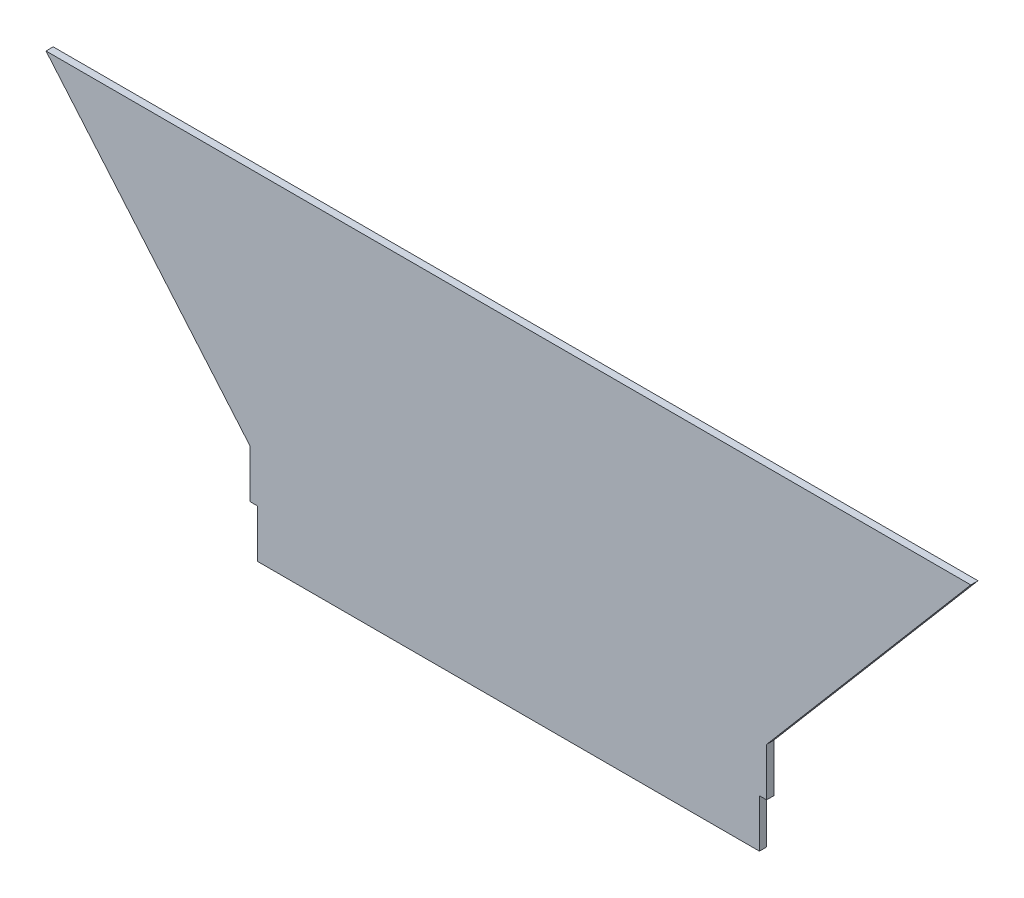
SolidWorks part; units mm, degrees
ref_plane "前视基准面" through (0, 0, 0) normal (0, 0, 1) x (1, 0, 0)
ref_plane "上视基准面" through (0, 0, 0) normal (0, 1, 0) x (1, 0, 0)
ref_plane "右视基准面" through (0, 0, 0) normal (1, 0, 0) x (0, 0, -1)
sketch "草图1" plane through (0, 0, 0) normal (0, 0, 1) x (1, 0, 0)
  line L1 (-107.5, -70) -> (107.5, -70)
  line L2 (-107.5, -70) -> (-107.5, 70)
  line L3 (-107.5, 70) -> (107.5, 70)
  line L4 (107.5, -70) -> (107.5, 70)
  line L5 (-107.5, -70) -> (107.5, 70) construction
  line L6 (-107.5, 70) -> (107.5, -70) construction
  point P0 (0, 0)
  dimension "D1" = 140
  dimension "D2" = 215
extrude "凸台-拉伸1" add sketch "草图1" along normal blind 3
sketch "草图3" plane through (0, 0, 0) normal (0, 0, 1) x (1, 0, 0)
  line L0 (-107.5, -30) -> (-192.5, 70)
  line L1 (-107.5, 70) -> (-107.5, -70) construction
  line L2 (-192.5, 70) -> (192.5, 70)
  line L3 (192.5, 70) -> (107.5, -30)
  line L4 (107.5, -70) -> (107.5, 70) construction
  line L5 (-107.5, -30) -> (107.5, -30)
  line L6 (0, -30) -> (0, 70) construction
  line L7 (-107.5, -70) -> (107.5, -70) construction
  line L8 (107.5, 70) -> (-107.5, 70) construction
  dimension "D1" = 40
  dimension "D2" = 385
extrude "凸台-拉伸3" add sketch "草图3" along normal blind 3
sketch "草图5" plane through (0, 0, 0) normal (0, 0, 1) x (1, 0, 0)
  line L0 (0, 70) -> (0, -70) construction
  line L1 (104.5, -50) -> (107.5, -50)
  line L2 (104.5, -50) -> (104.5, -70)
  line L3 (104.5, -70) -> (107.5, -70)
  line L4 (107.5, -50) -> (107.5, -70)
  line L5 (192.5, 70) -> (-192.5, 70) construction
  line L6 (-107.5, -70) -> (107.5, -70) construction
  line L7 (-107.5, -50) -> (-107.5, -70)
  line L8 (-104.5, -70) -> (-107.5, -70)
  line L9 (-104.5, -50) -> (-104.5, -70)
  line L10 (-104.5, -50) -> (-107.5, -50)
  point P15 (110.3838, -67.4244)
  point P17 (0, 0)
  point P18 (107.5, -70)
  dimension "D1" = 3
  dimension "D2" = 20
extrude "切除-拉伸1" cut sketch "草图5" along normal blind 3
